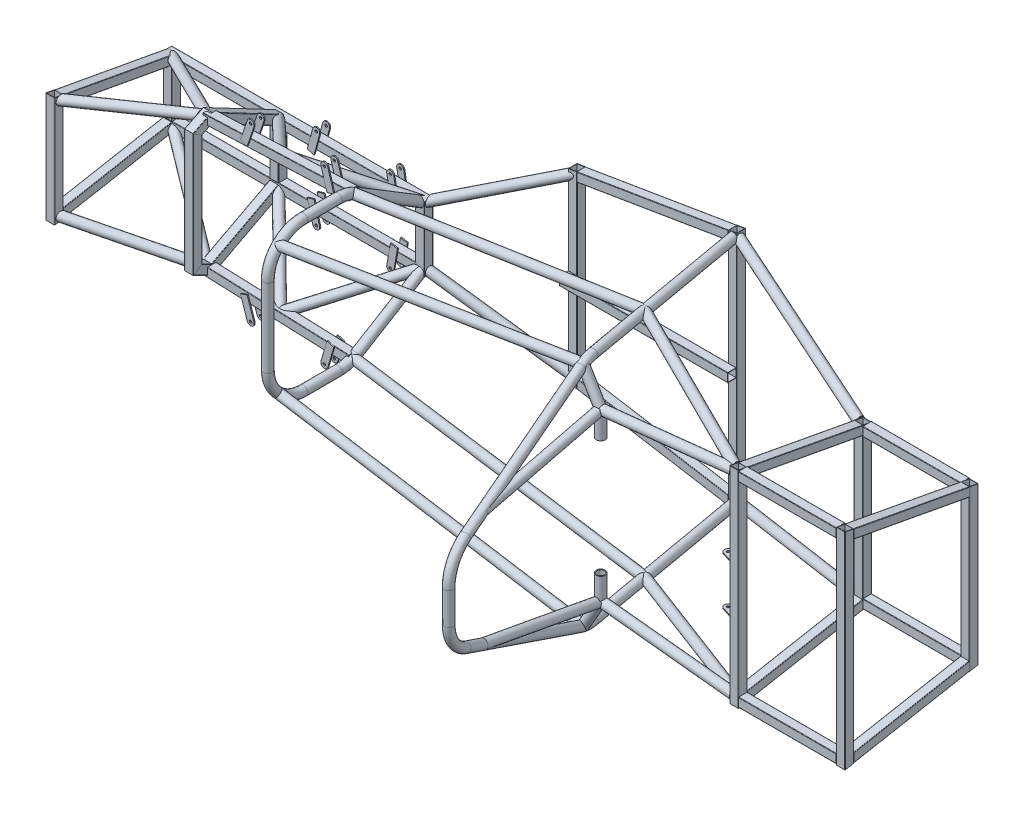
SolidWorks part; units mm, degrees
ref_plane "Front Plane" through (0, 0, 0) normal (0, 0, 1) x (1, 0, 0)
ref_plane "Top Plane" through (0, 0, 0) normal (0, 1, 0) x (1, 0, 0)
ref_plane "Right Plane" through (0, 0, 0) normal (1, 0, 0) x (0, 0, -1)
ref_plane "Upper_Arm" through (0, 0, 352.3616) normal (0, 0, 1) x (1, 0, 0)
ref_plane "Lower_Arm" through (0, 0, 152.4635) normal (0, 0, 1) x (1, 0, 0)
sketch "Main" plane through (0, 0, 152.4635) normal (0, 0, 1) x (1, 0, 0)
  line L0 (-531.7561, 0) -> (0, 0) construction
  line L1 (-531.7561, 79.6045) -> (178.2439, 79.6045)
  line L2 (-531.7561, 79.6045) -> (-531.7561, -79.6045)
  line L3 (-531.7561, -79.6045) -> (178.2439, -79.6045)
  line L4 (178.2439, 79.6045) -> (178.2439, -79.6045)
  line L5 (-231.7561, 79.6045) -> (-231.7561, -79.6045)
  dimension "D1" = 80
  dimension "D2" = 35
  dimension "D3" = 710
  dimension "D4" = 300
other "Structural Member1"
ref_plane "Plane2" through (-531.7561, 79.6045, 152.4635) normal (1, 0, 0) x (0, 1, 0)
sketch "Sketch121" plane through (-531.7561, 79.6045, 152.4635) normal (1, 0, 0) x (0, 1, 0)
  line L0 (-11.25, 11.25) -> (11.25, 11.25)
  line L1 (-11.25, 12.5) -> (11.25, 12.5)
  line L2 (-12.5, 11.25) -> (-12.5, -11.25)
  line L3 (-11.25, -12.5) -> (11.25, -12.5)
  line L4 (12.5, 11.25) -> (12.5, -11.25)
  line L5 (11.25, 11.25) -> (11.25, -11.25)
  line L6 (-11.25, -11.25) -> (11.25, -11.25)
  line L7 (-11.25, 11.25) -> (-11.25, -11.25)
  line L8 (0, 0) -> (12.5, 0) construction
  line L9 (0, 0) -> (0, 12.5) construction
  arc A1 (-12.5, -11.25) -> (-11.25, -12.5) centre (-11.25, -11.25) ccw
  arc A2 (11.25, -12.5) -> (12.5, -11.25) centre (11.25, -11.25) ccw
  arc A3 (11.25, 12.5) -> (12.5, 11.25) centre (11.25, 11.25) cw
  arc A4 (-11.25, 12.5) -> (-12.5, 11.25) centre (-11.25, 11.25) ccw
  arc A5 (11.25, 11.25) -> (11.25, 11.25) centre (11.25, 11.25) cw
  arc A6 (11.25, -11.25) -> (11.25, -11.25) centre (11.25, -11.25) ccw
  arc A7 (-11.25, -11.25) -> (-11.25, -11.25) centre (-11.25, -11.25) ccw
  arc A8 (-11.25, 11.25) -> (-11.25, 11.25) centre (-11.25, 11.25) ccw
  point P2 (0, 12.5)
  point P28 (12.5, 12.5)
  point P30 (12.5, 0)
  point P31 (12.5, -12.5)
  point P32 (0, -12.5)
  point P33 (-12.5, -12.5)
  point P34 (-12.5, 0)
  point P35 (-12.5, 12.5)
  point P36 (0, 0)
  dimension "D1" = 1.25
  dimension "D2" = 25
  dimension "D4" = 25
  dimension "D3" = 1.25
ref_plane "Lower_Frame" through (0, 0, 37.4635) normal (0, 0, 1) x (1, 0, 0)
sketch "Lower_Frame_sketch" plane through (0, 0, 37.4635) normal (0, 0, 1) x (1, 0, 0)
  line L0 (493.2439, 250) -> (493.2439, -250)
  line L1 (493.2439, -250) -> (943.2439, -325)
  line L2 (943.2439, -325) -> (943.2439, 325)
  line L3 (943.2439, 325) -> (493.2439, 250)
  line L4 (493.2439, 0) -> (943.2439, 0) construction
  line L6 (-531.7561, 0) -> (0, 0) construction
  line L7 (178.2439, 79.6045) -> (178.2439, -79.6045) construction
  dimension "D1" = 315
  dimension "D2" = 650
  dimension "D3" = 450
  dimension "D4" = 500
other "Structural Member2"
ref_plane "Plane3" through (493.2439, 250, 37.4635) normal (0, -1, 0) x (1, 0, 0)
sketch "Sketch1" plane through (493.2439, 250, 37.4635) normal (0, -1, 0) x (1, 0, 0)
  line L0 (-11.25, 11.25) -> (11.25, 11.25)
  line L1 (-11.25, 12.5) -> (11.25, 12.5)
  line L2 (-12.5, 11.25) -> (-12.5, -11.25)
  line L3 (-11.25, -12.5) -> (11.25, -12.5)
  line L4 (12.5, 11.25) -> (12.5, -11.25)
  line L5 (11.25, 11.25) -> (11.25, -11.25)
  line L6 (-11.25, -11.25) -> (11.25, -11.25)
  line L7 (-11.25, 11.25) -> (-11.25, -11.25)
  line L8 (0, 0) -> (12.5, 0) construction
  line L9 (0, 0) -> (0, 12.5) construction
  arc A1 (-12.5, -11.25) -> (-11.25, -12.5) centre (-11.25, -11.25) ccw
  arc A2 (11.25, -12.5) -> (12.5, -11.25) centre (11.25, -11.25) ccw
  arc A3 (11.25, 12.5) -> (12.5, 11.25) centre (11.25, 11.25) cw
  arc A4 (-11.25, 12.5) -> (-12.5, 11.25) centre (-11.25, 11.25) ccw
  arc A5 (11.25, 11.25) -> (11.25, 11.25) centre (11.25, 11.25) cw
  arc A6 (11.25, -11.25) -> (11.25, -11.25) centre (11.25, -11.25) ccw
  arc A7 (-11.25, -11.25) -> (-11.25, -11.25) centre (-11.25, -11.25) ccw
  arc A8 (-11.25, 11.25) -> (-11.25, 11.25) centre (-11.25, 11.25) ccw
  point P2 (0, 12.5)
  point P28 (12.5, 12.5)
  point P30 (12.5, 0)
  point P31 (12.5, -12.5)
  point P32 (0, -12.5)
  point P33 (-12.5, -12.5)
  point P34 (-12.5, 0)
  point P35 (-12.5, 12.5)
  point P36 (0, 0)
  dimension "D1" = 1.25
  dimension "D2" = 25
  dimension "D4" = 25
  dimension "D3" = 1.25
ref_plane "Bulkhead1" through (178.2439, 0, 0) normal (1, 0, 0) x (0, 0, -1)
sketch "Bulkhead1_Sketch" plane through (178.2439, 0, 0) normal (1, 0, 0) x (0, 0, -1)
  line L0 (-152.4635, 79.6045) -> (-343.5612, 195.5035)
  line L1 (-395.4183, 210) -> (-492.4635, 210)
  line L2 (-592.4635, 110) -> (-592.4635, -110)
  line L3 (-492.4635, -210) -> (-395.4183, -210)
  line L4 (-343.5612, -195.5035) -> (-152.4635, -79.6045)
  line L5 (-152.4635, 0) -> (-592.4635, 0) construction
  line L6 (-152.4635, 79.6045) -> (-152.4635, -79.6045) construction
  arc A0 (-343.5612, 195.5035) -> (-395.4183, 210) centre (-395.4183, 110) ccw
  arc A1 (-395.4183, -210) -> (-343.5612, -195.5035) centre (-395.4183, -110) ccw
  arc A2 (-592.4635, -110) -> (-492.4635, -210) centre (-492.4635, -110) ccw
  arc A3 (-492.4635, 210) -> (-592.4635, 110) centre (-492.4635, 110) ccw
  point P16 (-367.4635, -210)
  point P19 (-592.4635, -210)
  point P22 (-592.4635, 210)
  point P24 (-563.1742, -180.7107)
  dimension "D4" = 100
  dimension "D1" = 420
  dimension "D2" = 440
  dimension "D3" = 215
other "Structural Member3"
ref_plane "Plane4" through (178.2439, 79.6045, 152.4635) normal (0, 0.5186, 0.855) x (0, -0.855, 0.5186)
sketch "Sketch122" plane through (178.2439, 79.6045, 152.4635) normal (0, 0.5186, 0.855) x (0, -0.855, 0.5186)
  circle A0 centre (0, 0) radius 12.7
  circle A1 centre (0, 0) radius 10.3
  point P5 (0, 0)
  dimension "D1" = 25.4
  dimension "D2" = 2.4
other "Trim/Extend2"
other "Trim/Extend1"
ref_plane "Bulkhead2" through (-231.7561, 0, 0) normal (1, 0, 0) x (0, 0, -1)
sketch "Bulkhead2_sketch" plane through (-231.7561, 0, 0) normal (1, 0, 0) x (0, 0, -1)
  line L0 (-152.4635, 79.6045) -> (-352.4635, 184.6045)
  line L1 (-352.4635, 184.6045) -> (-392.4635, 165)
  line L2 (-392.4635, 165) -> (-392.4635, -165)
  line L3 (-392.4635, -165) -> (-352.4635, -184.6045)
  line L4 (-352.4635, -184.6045) -> (-152.4635, -79.6045)
  line L5 (-152.4635, 0) -> (-392.4635, 0) construction
  line L6 (-152.4635, 79.6045) -> (-152.4635, -79.6045) construction
  line L7 (-152.4635, -79.6045) -> (-352.4635, -79.6045) construction
  line L8 (-352.4635, -79.6045) -> (-352.4635, -184.6045) construction
  dimension "D1" = 330
  dimension "D2" = 200
  dimension "D3" = 40
  dimension "D4" = 105
other "Structural Member4"
ref_plane "Plane5" through (-231.7561, 79.6045, 152.4635) normal (0, 0.4648, 0.8854) x (0, -0.8854, 0.4648)
sketch "Sketch126" plane through (-231.7561, 79.6045, 152.4635) normal (0, 0.4648, 0.8854) x (0, -0.8854, 0.4648)
  line L0 (-11.25, 11.25) -> (11.25, 11.25)
  line L1 (-11.25, 12.5) -> (11.25, 12.5)
  line L2 (-12.5, 11.25) -> (-12.5, -11.25)
  line L3 (-11.25, -12.5) -> (11.25, -12.5)
  line L4 (12.5, 11.25) -> (12.5, -11.25)
  line L5 (11.25, 11.25) -> (11.25, -11.25)
  line L6 (-11.25, -11.25) -> (11.25, -11.25)
  line L7 (-11.25, 11.25) -> (-11.25, -11.25)
  line L8 (0, 0) -> (12.5, 0) construction
  line L9 (0, 0) -> (0, 12.5) construction
  arc A1 (-12.5, -11.25) -> (-11.25, -12.5) centre (-11.25, -11.25) ccw
  arc A2 (11.25, -12.5) -> (12.5, -11.25) centre (11.25, -11.25) ccw
  arc A3 (11.25, 12.5) -> (12.5, 11.25) centre (11.25, 11.25) cw
  arc A4 (-11.25, 12.5) -> (-12.5, 11.25) centre (-11.25, 11.25) ccw
  arc A5 (11.25, 11.25) -> (11.25, 11.25) centre (11.25, 11.25) cw
  arc A6 (11.25, -11.25) -> (11.25, -11.25) centre (11.25, -11.25) ccw
  arc A7 (-11.25, -11.25) -> (-11.25, -11.25) centre (-11.25, -11.25) ccw
  arc A8 (-11.25, 11.25) -> (-11.25, 11.25) centre (-11.25, 11.25) ccw
  point P2 (0, 12.5)
  point P28 (12.5, 12.5)
  point P30 (12.5, 0)
  point P31 (12.5, -12.5)
  point P32 (0, -12.5)
  point P33 (-12.5, -12.5)
  point P34 (-12.5, 0)
  point P35 (-12.5, 12.5)
  point P36 (0, 0)
  dimension "D1" = 1.25
  dimension "D2" = 25
  dimension "D4" = 25
  dimension "D3" = 1.25
other "Trim/Extend3"
other "Trim/Extend4"
ref_plane "Bulkhead3" through (-531.7561, 0, 0) normal (1, 0, 0) x (0, 0, -1)
sketch "Bulkhead3_sketch" plane through (-531.7561, 0, 0) normal (1, 0, 0) x (0, 0, -1)
  line L0 (-152.4635, 79.6045) -> (-482.4635, 140)
  line L1 (-482.4635, 140) -> (-482.4635, -140)
  line L2 (-482.4635, -140) -> (-152.4635, -79.6045)
  line L3 (-152.4635, 0) -> (-482.4635, 0) construction
  dimension "D1" = 280
  dimension "D2" = 330
other "Structural Member5"
ref_plane "Plane6" through (-531.7561, 79.6045, 152.4635) normal (0, 0.18, 0.9837) x (0, -0.9837, 0.18)
sketch "Sketch127" plane through (-531.7561, 79.6045, 152.4635) normal (0, 0.18, 0.9837) x (0, -0.9837, 0.18)
  line L0 (-11.25, 11.25) -> (11.25, 11.25)
  line L1 (-11.25, 12.5) -> (11.25, 12.5)
  line L2 (-12.5, 11.25) -> (-12.5, -11.25)
  line L3 (-11.25, -12.5) -> (11.25, -12.5)
  line L4 (12.5, 11.25) -> (12.5, -11.25)
  line L5 (11.25, 11.25) -> (11.25, -11.25)
  line L6 (-11.25, -11.25) -> (11.25, -11.25)
  line L7 (-11.25, 11.25) -> (-11.25, -11.25)
  line L8 (0, 0) -> (12.5, 0) construction
  line L9 (0, 0) -> (0, 12.5) construction
  arc A1 (-12.5, -11.25) -> (-11.25, -12.5) centre (-11.25, -11.25) ccw
  arc A2 (11.25, -12.5) -> (12.5, -11.25) centre (11.25, -11.25) ccw
  arc A3 (11.25, 12.5) -> (12.5, 11.25) centre (11.25, 11.25) cw
  arc A4 (-11.25, 12.5) -> (-12.5, 11.25) centre (-11.25, 11.25) ccw
  arc A5 (11.25, 11.25) -> (11.25, 11.25) centre (11.25, 11.25) cw
  arc A6 (11.25, -11.25) -> (11.25, -11.25) centre (11.25, -11.25) ccw
  arc A7 (-11.25, -11.25) -> (-11.25, -11.25) centre (-11.25, -11.25) ccw
  arc A8 (-11.25, 11.25) -> (-11.25, 11.25) centre (-11.25, 11.25) ccw
  point P2 (0, 12.5)
  point P28 (12.5, 12.5)
  point P30 (12.5, 0)
  point P31 (12.5, -12.5)
  point P32 (0, -12.5)
  point P33 (-12.5, -12.5)
  point P34 (-12.5, 0)
  point P35 (-12.5, 12.5)
  point P36 (0, 0)
  dimension "D1" = 1.25
  dimension "D2" = 25
  dimension "D4" = 25
  dimension "D3" = 1.25
other "Trim/Extend5"
other "Trim/Extend6"
ref_plane "Seat_Position" through (943.2439, 0, 0) normal (1, 0, 0) x (0, 0, -1)
ref_plane "Seat_Angle" through (908.395, 0, -160.1746) normal (0.9848, 0, -0.1736) x (-0.1736, 0, -0.9848)
sketch "Seat_Angle_sketch" plane through (908.395, 0, -160.1746) normal (0.9848, 0, -0.1736) x (-0.1736, 0, -0.9848)
  line L0 (-200.6869, 325) -> (-700.6869, 325)
  line L1 (-741.7234, 316.1922) -> (-1141.7234, 136.1922)
  line L2 (-1200.6869, 45) -> (-1200.6869, -45)
  line L3 (-1141.7234, -136.1922) -> (-741.7234, -316.1922)
  line L4 (-700.6869, -325) -> (-200.6869, -325)
  line L5 (-200.6869, 0) -> (-1200.6869, 0) construction
  line L6 (-200.6869, -325) -> (-200.6869, 325) construction
  arc A0 (-700.6869, 325) -> (-741.7234, 316.1922) centre (-700.6869, 225) ccw
  arc A1 (-741.7234, -316.1922) -> (-700.6869, -325) centre (-700.6869, -225) ccw
  arc A2 (-1200.6869, -45) -> (-1141.7234, -136.1922) centre (-1100.6869, -45) ccw
  arc A3 (-1141.7234, 136.1922) -> (-1200.6869, 45) centre (-1100.6869, 45) ccw
  dimension "D2" = 100
  dimension "D1" = 1000
  dimension "D3" = 500
  dimension "D4" = 90
other "Structural Member6"
ref_plane "Plane7" through (943.2439, 325, 37.4635) normal (0.1736, 0, 0.9848) x (0, -1, 0)
sketch "Sketch128" plane through (943.2439, 325, 37.4635) normal (0.1736, 0, 0.9848) x (0, -1, 0)
  circle A0 centre (0, 0) radius 12.7
  circle A1 centre (0, 0) radius 10.3
  point P5 (0, 0)
  dimension "D1" = 25.4
  dimension "D2" = 2.4
other "Trim/Extend7"
other "Trim/Extend8"
ref_plane "Through_Point" through (0, 0, 563.1742) normal (0, 0, 1) x (1, 0, 0)
sketch "Through_Point_Sketch" plane through (0, 0, 563.1742) normal (0, 0, 1) x (1, 0, 0)
  line L0 (178.2439, -180.7107) -> (1035.9409, -319.1072)
other "Structural Member7"
ref_plane "Plane8" through (178.2439, -180.7107, 563.1742) normal (0.9872, -0.1593, 0) x (0.1593, 0.9872, 0)
sketch "Sketch129" plane through (178.2439, -180.7107, 563.1742) normal (0.9872, -0.1593, 0) x (0.1593, 0.9872, 0)
  circle A0 centre (0, 0) radius 12.7
  circle A1 centre (0, 0) radius 10.3
  point P5 (0, 0)
  dimension "D1" = 25.4
  dimension "D2" = 2.4
other "Trim/Extend9"
other "Trim/Extend11"
ref_plane "Engine1" through (1473.2439, 0, 0) normal (1, 0, 0) x (0, 0, -1)
ref_plane "Engine2" through (1773.2439, 0, 0) normal (1, 0, 0) x (0, 0, -1)
sketch "Engine1_sketch" plane through (1473.2439, 0, 0) normal (1, 0, 0) x (0, 0, -1)
  line L2 (-37.4635, 0) -> (-1022.2713, 0) construction
  line L8 (-37.4635, 0) -> (-1022.2713, 0) construction
  line L9 (-213.1742, 210) -> (-213.1742, -210)
  line L10 (-213.1742, -210) -> (-563.1742, -275)
  line L11 (-563.1742, -275) -> (-563.1742, 275)
  line L12 (-213.1742, 210) -> (-563.1742, 275)
  line L13 (-563.1742, 423.4719) -> (-563.1742, -423.4719) construction
  point P7 (-563.1742, 0)
  point P8 (-213.1742, 0)
  dimension "D1" = 550
  dimension "D2" = 420
  dimension "D3" = 350
other "Structural Member8"
ref_plane "Plane9" through (1473.2439, -275, 563.1742) normal (0, 1, 0) x (0, 0, 1)
sketch "Sketch131" plane through (1473.2439, -275, 563.1742) normal (0, 1, 0) x (0, 0, 1)
  line L0 (-11.25, 11.25) -> (11.25, 11.25)
  line L1 (-11.25, 12.5) -> (11.25, 12.5)
  line L2 (-12.5, 11.25) -> (-12.5, -11.25)
  line L3 (-11.25, -12.5) -> (11.25, -12.5)
  line L4 (12.5, 11.25) -> (12.5, -11.25)
  line L5 (11.25, 11.25) -> (11.25, -11.25)
  line L6 (-11.25, -11.25) -> (11.25, -11.25)
  line L7 (-11.25, 11.25) -> (-11.25, -11.25)
  line L8 (0, 0) -> (12.5, 0) construction
  line L9 (0, 0) -> (0, 12.5) construction
  arc A1 (-12.5, -11.25) -> (-11.25, -12.5) centre (-11.25, -11.25) ccw
  arc A2 (11.25, -12.5) -> (12.5, -11.25) centre (11.25, -11.25) ccw
  arc A3 (11.25, 12.5) -> (12.5, 11.25) centre (11.25, 11.25) cw
  arc A4 (-11.25, 12.5) -> (-12.5, 11.25) centre (-11.25, 11.25) ccw
  arc A5 (11.25, 11.25) -> (11.25, 11.25) centre (11.25, 11.25) cw
  arc A6 (11.25, -11.25) -> (11.25, -11.25) centre (11.25, -11.25) ccw
  arc A7 (-11.25, -11.25) -> (-11.25, -11.25) centre (-11.25, -11.25) ccw
  arc A8 (-11.25, 11.25) -> (-11.25, 11.25) centre (-11.25, 11.25) ccw
  point P2 (0, 12.5)
  point P28 (12.5, 12.5)
  point P30 (12.5, 0)
  point P31 (12.5, -12.5)
  point P32 (0, -12.5)
  point P33 (-12.5, -12.5)
  point P34 (-12.5, 0)
  point P35 (-12.5, 12.5)
  point P36 (0, 0)
  dimension "D1" = 1.25
  dimension "D2" = 25
  dimension "D4" = 25
  dimension "D3" = 1.25
sketch "Engine2_sketch" plane through (1773.2439, 0, 0) normal (1, 0, 0) x (0, 0, -1)
  line L0 (-213.1742, 210) -> (-213.1742, -210) construction
  line L1 (-213.1742, -210) -> (-563.1742, -275) construction
  line L2 (-563.1742, -275) -> (-563.1742, 275) construction
  line L3 (-213.1742, 210) -> (-563.1742, 275) construction
  line L4 (-213.1742, 210) -> (-213.1742, -210)
  line L5 (-213.1742, -210) -> (-563.1742, -275)
  line L6 (-563.1742, -275) -> (-563.1742, 275)
  line L7 (-213.1742, 210) -> (-563.1742, 275)
sketch "Engine_Mount" plane through (0, 0, 563.1742) normal (0, 0, 1) x (1, 0, 0)
  line L0 (1035.9409, -319.1072) -> (1085.9409, -234.1072)
  line L1 (1085.9409, -234.1072) -> (1085.9409, -186.3813)
  line L2 (1035.9409, -319.1072) -> (1085.9409, -319.1072) construction
  line L3 (1085.9409, -319.1072) -> (1085.9409, -234.1072) construction
  line L4 (1085.9409, -234.1072) -> (1473.2439, -275)
  dimension "D1" = 50
  dimension "D2" = 85
other "Structural Member21"
ref_plane "Plane18" through (1085.9409, -234.1072, 563.1742) normal (0, 1, 0) x (-1, 0, 0)
sketch "Sketch139" plane through (1085.9409, -234.1072, 563.1742) normal (0, 1, 0) x (-1, 0, 0)
  circle A0 centre (0, 0) radius 12.7
  circle A1 centre (0, 0) radius 10.3
  point P5 (0, 0)
  dimension "D1" = 25.4
  dimension "D2" = 2.4
other "Structural Member9"
ref_plane "Plane10" through (1035.9409, -319.1072, 563.1742) normal (0.507, 0.8619, 0) x (-0.8619, 0.507, 0)
sketch "Sketch130" plane through (1035.9409, -319.1072, 563.1742) normal (0.507, 0.8619, 0) x (-0.8619, 0.507, 0)
  circle A0 centre (0, 0) radius 12.7
  circle A1 centre (0, 0) radius 10.3
  point P5 (0, 0)
  dimension "D1" = 25.4
  dimension "D2" = 2.4
other "Trim/Extend26"
other "Trim/Extend27"
other "Structural Member10"
ref_plane "Plane11" through (1773.2439, -275, 563.1742) normal (0, 1, 0) x (0, 0, 1)
sketch "Sketch132" plane through (1773.2439, -275, 563.1742) normal (0, 1, 0) x (0, 0, 1)
  line L0 (-11.25, 11.25) -> (11.25, 11.25)
  line L1 (-11.25, 12.5) -> (11.25, 12.5)
  line L2 (-12.5, 11.25) -> (-12.5, -11.25)
  line L3 (-11.25, -12.5) -> (11.25, -12.5)
  line L4 (12.5, 11.25) -> (12.5, -11.25)
  line L5 (11.25, 11.25) -> (11.25, -11.25)
  line L6 (-11.25, -11.25) -> (11.25, -11.25)
  line L7 (-11.25, 11.25) -> (-11.25, -11.25)
  line L8 (0, 0) -> (12.5, 0) construction
  line L9 (0, 0) -> (0, 12.5) construction
  arc A1 (-12.5, -11.25) -> (-11.25, -12.5) centre (-11.25, -11.25) ccw
  arc A2 (11.25, -12.5) -> (12.5, -11.25) centre (11.25, -11.25) ccw
  arc A3 (11.25, 12.5) -> (12.5, 11.25) centre (11.25, 11.25) cw
  arc A4 (-11.25, 12.5) -> (-12.5, 11.25) centre (-11.25, 11.25) ccw
  arc A5 (11.25, 11.25) -> (11.25, 11.25) centre (11.25, 11.25) cw
  arc A6 (11.25, -11.25) -> (11.25, -11.25) centre (11.25, -11.25) ccw
  arc A7 (-11.25, -11.25) -> (-11.25, -11.25) centre (-11.25, -11.25) ccw
  arc A8 (-11.25, 11.25) -> (-11.25, 11.25) centre (-11.25, 11.25) ccw
  point P2 (0, 12.5)
  point P28 (12.5, 12.5)
  point P30 (12.5, 0)
  point P31 (12.5, -12.5)
  point P32 (0, -12.5)
  point P33 (-12.5, -12.5)
  point P34 (-12.5, 0)
  point P35 (-12.5, 12.5)
  point P36 (0, 0)
  dimension "D1" = 1.25
  dimension "D2" = 25
  dimension "D4" = 25
  dimension "D3" = 1.25
sketch3d "3DSketch7"
  line L0 (1085.9409, -234.1072, 563.1742) -> (1096.3377, -162.9242, 905.7014)
  line L1 (1106.6532, -136.1922, 964.2035) -> (1037.1939, -316.1922, 570.2804) construction
  dimension "D1" = 350
other "Structural Member17"
ref_plane "Plane20" through (1085.9409, -234.1072, 563.1742) normal (0.0297, 0.2034, 0.9786) x (0.9996, -0.0031, -0.0297)
sketch "Sketch141" plane through (1085.9409, -234.1072, 563.1742) normal (0.0297, 0.2034, 0.9786) x (0.9996, -0.0031, -0.0297)
  circle A0 centre (0, 0) radius 12.7
  circle A1 centre (0, 0) radius 10.3
  point P5 (0, 0)
  dimension "D1" = 25.4
  dimension "D2" = 2.4
other "Trim/Extend14"
other "Trim/Extend32"
ref_plane "Plane1" through (0, 0, 352.4635) normal (0, 0, 1) x (1, 0, 0)
sketch "Sketch5" plane through (0, 0, 352.4635) normal (0, 0, 1) x (1, 0, 0)
  line L0 (-231.7561, -184.6045) -> (178.2439, -200.3044)
  line L3 (178.2439, -200.3044) -> (998.7869, -325)
other "Structural Member11"
ref_plane "Plane12" through (-231.7561, -184.6045, 352.4635) normal (0.9993, -0.0383, 0) x (0.0383, 0.9993, 0)
sketch "Sketch153" plane through (-231.7561, -184.6045, 352.4635) normal (0.9993, -0.0383, 0) x (0.0383, 0.9993, 0)
  line L0 (-11.25, 11.25) -> (11.25, 11.25)
  line L1 (-11.25, 12.5) -> (11.25, 12.5)
  line L2 (-12.5, 11.25) -> (-12.5, -11.25)
  line L3 (-11.25, -12.5) -> (11.25, -12.5)
  line L4 (12.5, 11.25) -> (12.5, -11.25)
  line L5 (11.25, 11.25) -> (11.25, -11.25)
  line L6 (-11.25, -11.25) -> (11.25, -11.25)
  line L7 (-11.25, 11.25) -> (-11.25, -11.25)
  line L8 (0, 0) -> (12.5, 0) construction
  line L9 (0, 0) -> (0, 12.5) construction
  arc A1 (-12.5, -11.25) -> (-11.25, -12.5) centre (-11.25, -11.25) ccw
  arc A2 (11.25, -12.5) -> (12.5, -11.25) centre (11.25, -11.25) ccw
  arc A3 (11.25, 12.5) -> (12.5, 11.25) centre (11.25, 11.25) cw
  arc A4 (-11.25, 12.5) -> (-12.5, 11.25) centre (-11.25, 11.25) ccw
  arc A5 (11.25, 11.25) -> (11.25, 11.25) centre (11.25, 11.25) cw
  arc A6 (11.25, -11.25) -> (11.25, -11.25) centre (11.25, -11.25) ccw
  arc A7 (-11.25, -11.25) -> (-11.25, -11.25) centre (-11.25, -11.25) ccw
  arc A8 (-11.25, 11.25) -> (-11.25, 11.25) centre (-11.25, 11.25) ccw
  point P2 (0, 12.5)
  point P28 (12.5, 12.5)
  point P30 (12.5, 0)
  point P31 (12.5, -12.5)
  point P32 (0, -12.5)
  point P33 (-12.5, -12.5)
  point P34 (-12.5, 0)
  point P35 (-12.5, 12.5)
  point P36 (0, 0)
  dimension "D1" = 1.25
  dimension "D2" = 25
  dimension "D4" = 25
  dimension "D3" = 1.25
other "Structural Member16"
ref_plane "Plane19" through (178.2439, -200.3044, 352.4635) normal (0.9886, -0.1502, 0) x (0.1502, 0.9886, 0)
sketch "Sketch140" plane through (178.2439, -200.3044, 352.4635) normal (0.9886, -0.1502, 0) x (0.1502, 0.9886, 0)
  circle A0 centre (0, 0) radius 12.7
  circle A1 centre (0, 0) radius 10.3
  point P5 (0, 0)
  dimension "D1" = 25.4
  dimension "D2" = 2.4
other "Trim/Extend12"
other "Trim/Extend13"
sketch3d "3DSketch8"
  line L0 (-531.7561, -140, 482.4635) -> (-231.7561, -184.6045, 352.4635)
  line L1 (-531.7561, -79.6045, 152.4635) -> (-231.7561, -184.6045, 352.4635)
other "Structural Member12"
ref_plane "Plane13" through (-531.7561, -140, 482.4635) normal (0.9091, -0.1352, -0.394) x (-0.3638, 0.2028, -0.9091)
sketch "Sketch134" plane through (-531.7561, -140, 482.4635) normal (0.9091, -0.1352, -0.394) x (-0.3638, 0.2028, -0.9091)
  circle A0 centre (0, 0) radius 12.7
  circle A1 centre (0, 0) radius 10.3
  point P5 (0, 0)
  dimension "D1" = 25.4
  dimension "D2" = 2.4
other "Trim/Extend16"
other "Trim/Extend17"
sketch3d "3DSketch9"
  line L0 (-231.7561, -79.6045, 152.4635) -> (-26.7561, -192.4544, 352.4635)
  line L1 (-231.7561, -184.6045, 352.4635) -> (178.2439, -200.3044, 352.4635) construction
  line L2 (-26.7561, -192.4544, 352.4635) -> (178.2439, -79.6045, 152.4635)
other "Structural Member13"
ref_plane "Plane14" through (-231.7561, -79.6045, 152.4635) normal (0.6659, -0.3666, 0.6497) x (0.7312, 0.148, -0.6659)
sketch "Sketch135" plane through (-231.7561, -79.6045, 152.4635) normal (0.6659, -0.3666, 0.6497) x (0.7312, 0.148, -0.6659)
  circle A0 centre (0, 0) radius 12.7
  circle A1 centre (0, 0) radius 10.3
  point P5 (0, 0)
  dimension "D1" = 25.4
  dimension "D2" = 2.4
other "Trim/Extend18"
other "Trim/Extend19"
sketch3d "3DSketch10"
  line L1 (178.2439, -79.6045, 152.4635) -> (493.2439, -250, 37.4635)
other "Structural Member14"
ref_plane "Plane15" through (178.2439, -79.6045, 152.4635) normal (0.8374, -0.453, -0.3057) x (-0.0101, 0.5464, -0.8374)
sketch "Sketch136" plane through (178.2439, -79.6045, 152.4635) normal (0.8374, -0.453, -0.3057) x (-0.0101, 0.5464, -0.8374)
  circle A0 centre (0, 0) radius 12.7
  circle A1 centre (0, 0) radius 10.3
  point P5 (0, 0)
  dimension "D1" = 25.4
  dimension "D2" = 2.4
other "Trim/Extend20"
other "Trim/Extend21"
sketch3d "3DSketch11"
  line L0 (998.7869, -325, 352.4635) -> (1473.2439, -275, 563.1742)
  line L1 (943.2439, -325, 37.4635) -> (1473.2439, -210, 213.1742)
  line L2 (1473.2439, -210, 213.1742) -> (1773.2439, -210, 213.1742)
  line L3 (1473.2439, -275, 563.1742) -> (1773.2439, -275, 563.1742)
other "Structural Member15"
ref_plane "Plane16" through (998.7869, -325, 352.4635) normal (0.9097, 0.0959, 0.404) x (0.4106, -0.0621, -0.9097)
sketch "Sketch137" plane through (998.7869, -325, 352.4635) normal (0.9097, 0.0959, 0.404) x (0.4106, -0.0621, -0.9097)
  circle A0 centre (0, 0) radius 12.7
  circle A1 centre (0, 0) radius 10.3
  point P5 (0, 0)
  dimension "D1" = 25.4
  dimension "D2" = 2.4
other "Trim/Extend22"
other "Trim/Extend23"
other "Structural Member20"
ref_plane "Plane17" through (1473.2439, -275, 563.1742) normal (1, 0, 0) x (0, 0, -1)
sketch "Sketch138" plane through (1473.2439, -275, 563.1742) normal (1, 0, 0) x (0, 0, -1)
  line L0 (-11.25, 11.25) -> (11.25, 11.25)
  line L1 (-11.25, 12.5) -> (11.25, 12.5)
  line L2 (-12.5, 11.25) -> (-12.5, -11.25)
  line L3 (-11.25, -12.5) -> (11.25, -12.5)
  line L4 (12.5, 11.25) -> (12.5, -11.25)
  line L5 (11.25, 11.25) -> (11.25, -11.25)
  line L6 (-11.25, -11.25) -> (11.25, -11.25)
  line L7 (-11.25, 11.25) -> (-11.25, -11.25)
  line L8 (0, 0) -> (12.5, 0) construction
  line L9 (0, 0) -> (0, 12.5) construction
  arc A1 (-12.5, -11.25) -> (-11.25, -12.5) centre (-11.25, -11.25) ccw
  arc A2 (11.25, -12.5) -> (12.5, -11.25) centre (11.25, -11.25) ccw
  arc A3 (11.25, 12.5) -> (12.5, 11.25) centre (11.25, 11.25) cw
  arc A4 (-11.25, 12.5) -> (-12.5, 11.25) centre (-11.25, 11.25) ccw
  arc A5 (11.25, 11.25) -> (11.25, 11.25) centre (11.25, 11.25) cw
  arc A6 (11.25, -11.25) -> (11.25, -11.25) centre (11.25, -11.25) ccw
  arc A7 (-11.25, -11.25) -> (-11.25, -11.25) centre (-11.25, -11.25) ccw
  arc A8 (-11.25, 11.25) -> (-11.25, 11.25) centre (-11.25, 11.25) ccw
  point P2 (0, 12.5)
  point P28 (12.5, 12.5)
  point P30 (12.5, 0)
  point P31 (12.5, -12.5)
  point P32 (0, -12.5)
  point P33 (-12.5, -12.5)
  point P34 (-12.5, 0)
  point P35 (-12.5, 12.5)
  point P36 (0, 0)
  dimension "D1" = 1.25
  dimension "D2" = 25
  dimension "D4" = 25
  dimension "D3" = 1.25
other "Trim/Extend24"
other "Trim/Extend25"
other "Trim/Extend29"
mirror "Mirror1" about plane through (0, 0, 0) normal (0, 1, 0)
sketch "Sketch142" plane through (0, 0, 49.9635) normal (0, 0, 1) x (1, 0, 0)
  line L0 (493.2439, 0) -> (943.2439, 0) construction
  line L1 (481.9939, 0) -> (954.4939, 0)
  line L2 (954.4939, -339.5474) -> (954.4939, 339.5474) construction
  line L3 (481.9939, -260.7974) -> (481.9939, 260.7974) construction
other "Structural Member25"
ref_plane "Plane28" through (481.9939, 0, 49.9635) normal (1, 0, 0) x (0, 1, 0)
sketch "Sketch151" plane through (481.9939, 0, 62.4635) normal (1, 0, 0) x (0, 1, 0)
  line L0 (-11.25, 11.25) -> (11.25, 11.25)
  line L1 (-11.25, 12.5) -> (11.25, 12.5)
  line L2 (-12.5, 11.25) -> (-12.5, -11.25)
  line L3 (-11.25, -12.5) -> (11.25, -12.5)
  line L4 (12.5, 11.25) -> (12.5, -11.25)
  line L5 (11.25, 11.25) -> (11.25, -11.25)
  line L6 (-11.25, -11.25) -> (11.25, -11.25)
  line L7 (-11.25, 11.25) -> (-11.25, -11.25)
  line L8 (0, 0) -> (12.5, 0) construction
  line L9 (0, 0) -> (0, 12.5) construction
  arc A1 (-12.5, -11.25) -> (-11.25, -12.5) centre (-11.25, -11.25) ccw
  arc A2 (11.25, -12.5) -> (12.5, -11.25) centre (11.25, -11.25) ccw
  arc A3 (11.25, 12.5) -> (12.5, 11.25) centre (11.25, 11.25) cw
  arc A4 (-11.25, 12.5) -> (-12.5, 11.25) centre (-11.25, 11.25) ccw
  arc A5 (11.25, 11.25) -> (11.25, 11.25) centre (11.25, 11.25) cw
  arc A6 (11.25, -11.25) -> (11.25, -11.25) centre (11.25, -11.25) ccw
  arc A7 (-11.25, -11.25) -> (-11.25, -11.25) centre (-11.25, -11.25) ccw
  arc A8 (-11.25, 11.25) -> (-11.25, 11.25) centre (-11.25, 11.25) ccw
  point P2 (0, 12.5)
  point P28 (12.5, 12.5)
  point P30 (12.5, 0)
  point P31 (12.5, -12.5)
  point P32 (0, -12.5)
  point P33 (-12.5, -12.5)
  point P34 (-12.5, 0)
  point P35 (-12.5, 12.5)
  point P36 (0, 0)
  dimension "D1" = 1.25
  dimension "D2" = 25
  dimension "D4" = 25
  dimension "D3" = 1.25
sketch "Sketch156" plane through (0, 0, 364.9635) normal (0, 0, 1) x (1, 0, 0)
  line L0 (112.8393, 241.316) -> (129.886, 183.7885) construction
  line L1 (103.2514, 238.4749) -> (120.298, 180.9474)
  line L2 (122.4272, 244.1571) -> (139.4739, 186.6297)
  line L3 (120.298, 180.9474) -> (139.4739, 186.6297)
  line L4 (112.8393, 241.316) -> (129.886, 183.7885) construction
  line L5 (108.3386, 256.5004) -> (22.3246, 546.7731) construction
  arc A0 (103.2514, 238.4749) -> (122.4272, 244.1571) centre (112.8393, 241.316) cw
  circle A1 centre (112.8393, 241.316) radius 3.5
  circle A2 centre (112.8393, 241.316) radius 3.175 construction
  dimension "D1" = 20
  dimension "D2" = 60
  dimension "D3" = 7
extrude "Boss-Extrude2" add sketch "Sketch156" along normal blind 3 separate body
sketch "Sketch157" plane through (0, 0, 339.9635) normal (0, 0, -1) x (-1, 0, 0)
  line L3 (-122.4272, 244.1571) -> (-139.4739, 186.6297)
  line L4 (-139.4739, 186.6297) -> (-120.298, 180.9474)
  line L5 (-120.298, 180.9474) -> (-103.2514, 238.4749)
  line L6 (-122.4272, 244.1571) -> (-139.4739, 186.6297)
  line L7 (-139.4739, 186.6297) -> (-120.298, 180.9474)
  line L8 (-120.298, 180.9474) -> (-103.2514, 238.4749)
  circle A0 centre (-112.8393, 241.316) radius 3.5 construction
  arc A1 (-103.2514, 238.4749) -> (-122.4272, 244.1571) centre (-112.8393, 241.316) ccw
  arc A2 (-103.2514, 238.4749) -> (-122.4272, 244.1571) centre (-112.8393, 241.316) ccw
  circle A3 centre (-112.8393, 241.316) radius 3.5
  dimension "D1" = 0
extrude "Boss-Extrude3" add sketch "Sketch157" along normal blind 3 separate body
sketch "Sketch162" plane through (0, 0, 364.9635) normal (0, 0, 1) x (1, 0, 0)
  line L0 (-94.7229, 241.316) -> (-113.8788, 184.4561) construction
  line L1 (-104.1996, 244.5087) -> (-123.3555, 187.6488)
  line L2 (-85.2463, 238.1234) -> (-104.4022, 181.2635)
  line L3 (-123.3555, 187.6488) -> (-104.4022, 181.2635)
  line L4 (-94.7229, 241.316) -> (-113.8788, 184.4561) construction
  line L5 (8.2729, 547.0311) -> (-89.665, 256.3249) construction
  arc A0 (-104.1996, 244.5087) -> (-85.2463, 238.1234) centre (-94.7229, 241.316) cw
  circle A1 centre (-94.7229, 241.316) radius 3.5
  arc A2 (-94.4659, 246.2624) -> (-94.98, 236.3697) centre (-94.7229, 241.316) ccw construction
  dimension "D1" = 20
  dimension "D2" = 60
  dimension "D3" = 7
extrude "Boss-Extrude7" add sketch "Sketch162" along normal blind 3 separate body
sketch "Sketch163" plane through (0, 0, 339.9635) normal (0, 0, -1) x (-1, 0, 0)
  line L3 (123.3555, 187.6488) -> (104.1996, 244.5087)
  line L4 (104.4022, 181.2635) -> (123.3555, 187.6488)
  line L5 (85.2463, 238.1234) -> (104.4022, 181.2635)
  line L6 (123.3555, 187.6488) -> (104.1996, 244.5087)
  line L7 (104.4022, 181.2635) -> (123.3555, 187.6488)
  line L8 (85.2463, 238.1234) -> (104.4022, 181.2635)
  circle A0 centre (94.7229, 241.316) radius 3.5 construction
  arc A1 (104.1996, 244.5087) -> (85.2463, 238.1234) centre (94.7229, 241.316) ccw
  arc A2 (104.1996, 244.5087) -> (85.2463, 238.1234) centre (94.7229, 241.316) ccw
  circle A3 centre (94.7229, 241.316) radius 3.5
  dimension "D1" = 0
extrude "Boss-Extrude8" add sketch "Sketch163" along normal blind 3 separate body
sketch "Sketch164" plane through (0, 0, 164.9635) normal (0, 0, 1) x (1, 0, 0)
  line L0 (98.2439, 114.6045) -> (108.641, 55.5121) construction
  line L1 (88.3952, 112.8716) -> (98.7923, 53.7793)
  line L2 (108.0927, 116.3373) -> (118.4897, 57.245)
  line L3 (98.7923, 53.7793) -> (118.4897, 57.245)
  line L4 (98.2439, 114.6045) -> (108.641, 55.5121) construction
  line L5 (95.4931, 130.2389) -> (23.2005, 541.1185) construction
  arc A0 (88.3952, 112.8716) -> (108.0927, 116.3373) centre (98.2439, 114.6045) cw
  circle A1 centre (98.2439, 114.6045) radius 3.5
  arc A2 (97.9047, 119.5458) -> (98.5832, 109.6631) centre (98.2439, 114.6045) ccw construction
  dimension "D1" = 20
  dimension "D2" = 60
  dimension "D3" = 7
extrude "Boss-Extrude9" add sketch "Sketch164" along normal blind 3 separate body
sketch "Sketch165" plane through (0, 0, 164.9635) normal (0, 0, 1) x (1, 0, 0)
  line L0 (-110.2392, 114.6045) -> (-125.79, 56.6547) construction
  line L1 (-119.8974, 117.1963) -> (-135.4483, 59.2465)
  line L2 (-100.5809, 112.0126) -> (-116.1317, 54.0629)
  line L3 (-135.4483, 59.2465) -> (-116.1317, 54.0629)
  line L4 (-110.2392, 114.6045) -> (-125.79, 56.6547) construction
  line L5 (4.4377, 541.9447) -> (-106.1247, 129.9366) construction
  arc A0 (-119.8974, 117.1963) -> (-100.5809, 112.0126) centre (-110.2392, 114.6045) cw
  circle A1 centre (-110.2392, 114.6045) radius 3.5
  arc A2 (-110.7309, 109.6759) -> (-109.7475, 119.533) centre (-110.2392, 114.6045) ccw construction
  dimension "D1" = 20
  dimension "D2" = 60
  dimension "D3" = 7
extrude "Boss-Extrude11" add sketch "Sketch165" along normal blind 3 separate body
sketch "Sketch166" plane through (0, 0, 139.9635) normal (0, 0, -1) x (-1, 0, 0)
  line L3 (-98.7923, 53.7793) -> (-88.3952, 112.8716)
  line L4 (-118.4897, 57.245) -> (-98.7923, 53.7793)
  line L5 (-108.0927, 116.3373) -> (-118.4897, 57.245)
  line L6 (-98.7923, 53.7793) -> (-88.3952, 112.8716)
  line L7 (-118.4897, 57.245) -> (-98.7923, 53.7793)
  line L8 (-108.0927, 116.3373) -> (-118.4897, 57.245)
  circle A0 centre (-98.2439, 114.6045) radius 3.5 construction
  arc A1 (-88.3952, 112.8716) -> (-108.0927, 116.3373) centre (-98.2439, 114.6045) ccw
  arc A2 (-88.3952, 112.8716) -> (-108.0927, 116.3373) centre (-98.2439, 114.6045) ccw
  circle A3 centre (-98.2439, 114.6045) radius 3.5
  dimension "D1" = 0
extrude "Boss-Extrude10" add sketch "Sketch166" along normal blind 3 separate body
sketch "Sketch167" plane through (0, 0, 139.9635) normal (0, 0, -1) x (-1, 0, 0)
  line L3 (100.5809, 112.0126) -> (116.1317, 54.0629)
  line L4 (116.1317, 54.0629) -> (135.4483, 59.2465)
  line L5 (135.4483, 59.2465) -> (119.8974, 117.1963)
  line L6 (100.5809, 112.0126) -> (116.1317, 54.0629)
  line L7 (116.1317, 54.0629) -> (135.4483, 59.2465)
  line L8 (135.4483, 59.2465) -> (119.8974, 117.1963)
  circle A0 centre (110.2392, 114.6045) radius 3.5 construction
  arc A1 (119.8974, 117.1963) -> (100.5809, 112.0126) centre (110.2392, 114.6045) ccw
  arc A2 (119.8974, 117.1963) -> (100.5809, 112.0126) centre (110.2392, 114.6045) ccw
  circle A3 centre (110.2392, 114.6045) radius 3.5
  dimension "D1" = 0
extrude "Boss-Extrude12" add sketch "Sketch167" along normal blind 3 separate body
mirror "Mirror4" about plane through (0, 0, 0) normal (0, 1, 0)
sketch "Sketch161" plane through (0, -82.8782, 0) normal (0, -1, 0) x (1, 0, 0)
  line L0 (1430.1127, 549.4845) -> (1479.6066, 565.1937) construction
  line L1 (1433.1379, 539.9531) -> (1460.7439, 548.7151)
  line L2 (1427.0875, 559.0159) -> (1460.7439, 569.6983)
  line L4 (1430.1127, 549.4845) -> (1471.3659, 562.5781) construction
  line L5 (1460.7439, 574.4242) -> (1460.7439, 551.9242) construction
  line L6 (1460.7439, 569.6983) -> (1460.7439, 548.7151)
  line L7 (1427.0875, 559.0159) -> (1468.3407, 572.1095) construction
  line L8 (1433.1379, 539.9531) -> (1474.3911, 553.0467) construction
  arc A0 (1433.1379, 539.9531) -> (1427.0875, 559.0159) centre (1430.1127, 549.4845) cw
  circle A1 centre (1430.1127, 549.4845) radius 3.5
  circle A2 centre (1430.1127, 549.4845) radius 5.6 construction
  point P12 (1473.2439, 563.1742)
  dimension "D1" = 20
  dimension "D3" = 7
extrude "Boss-Extrude6" add sketch "Sketch161" along normal blind 3 separate body
ref_plane "mirror" through (0, -17.1, 0) normal (0, 1, 0) x (-1, 0, 0)
mirror "Mirror3" about plane through (0, -17.1, 0) normal (0, 1, 0)
